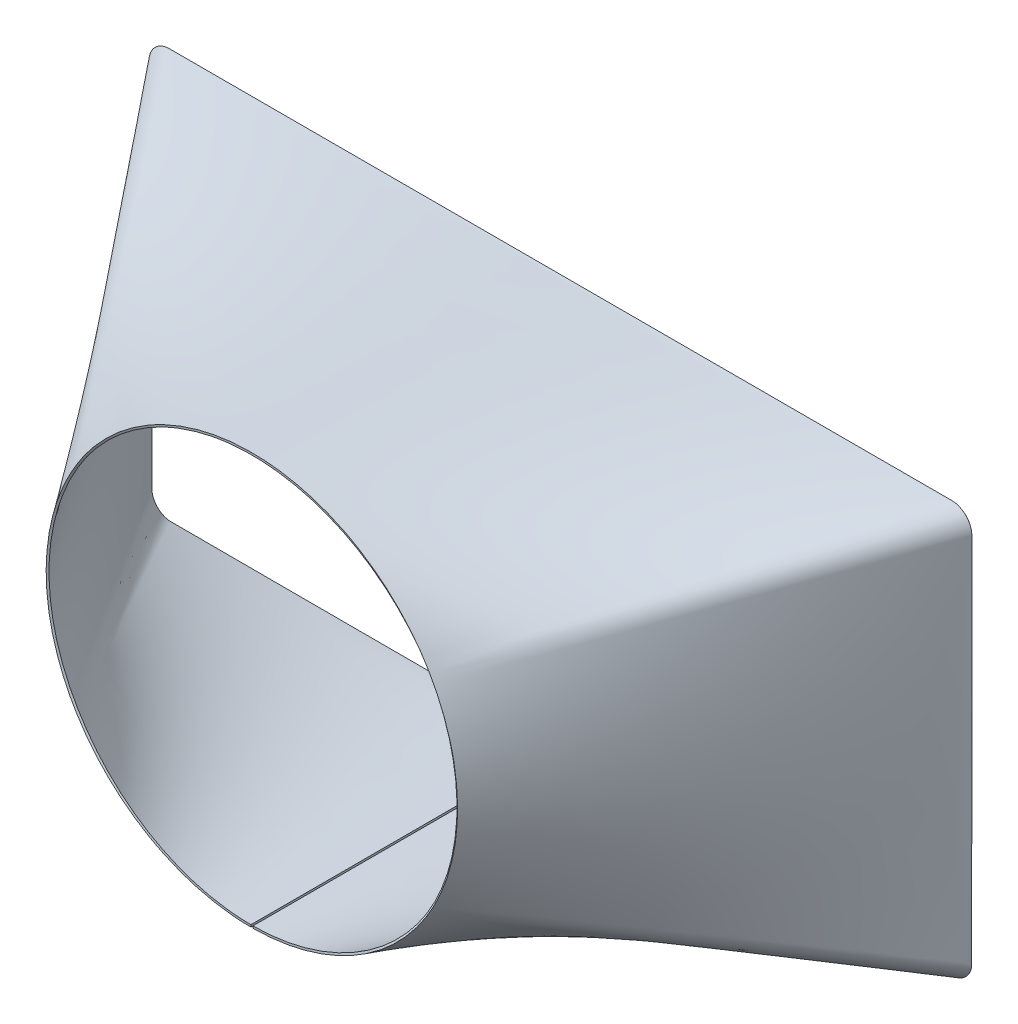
SolidWorks part; units mm, degrees
ref_plane "前视基准面" through (0, 0, 0) normal (0, 0, 1) x (1, 0, 0)
ref_plane "上视基准面" through (0, 0, 0) normal (0, 1, 0) x (1, 0, 0)
ref_plane "右视基准面" through (0, 0, 0) normal (1, 0, 0) x (0, 0, -1)
sketch "草图1" plane through (0, 0, 0) normal (0, 0, 1) x (1, 0, 0)
  line L0 (-0.5, -100) -> (-0.5, 0) construction
  line L1 (190, -100) -> (0.5, -100)
  line L2 (200, -90) -> (200, 90)
  line L3 (190, 100) -> (-190, 100)
  line L4 (-200, -90) -> (-200, 90)
  line L5 (200, -100) -> (-200, 100) construction
  line L6 (200, 100) -> (-200, -100) construction
  line L7 (-0.5, 0) -> (0.5, 0) construction
  line L8 (0.5, 0) -> (0.5, -100) construction
  line L9 (-0.5, -100) -> (-190, -100)
  arc A0 (200, 90) -> (190, 100) centre (190, 90) ccw
  arc A1 (200, -90) -> (190, -100) centre (190, -90) cw
  arc A2 (-200, -90) -> (-190, -100) centre (-190, -90) ccw
  arc A3 (-200, 90) -> (-190, 100) centre (-190, 90) cw
  point P0 (0, 0)
  dimension "R" = 10
  dimension "a" = 400
  dimension "b" = 200
  dimension "D3" = 1
ref_plane "基准面1" through (0, 0, 150) normal (0, 0, 1) x (1, 0, 0)
sketch "草图2" plane through (0, 0, 150) normal (0, 0, 1) x (1, 0, 0)
  line L0 (-0.5, 0) -> (0.5, 0) construction
  line L1 (0.5, 0) -> (0.5, -99.9987) construction
  line L2 (-0.5, 0) -> (-0.5, -99.9987) construction
  arc A0 (0.5, -99.9987) -> (-0.5, -99.9987) centre (0, 0) ccw
  dimension "r" = 100
  dimension "D1" = 1
sheet metal parameters "钣金1" thickness 1 parameters "D1"=0.7366, "厚度"=1
lofted bend "放样折弯1" thickness 1 parameters "D1"=0, "D12"=1
other "自由形折弯1" parameters "D1"=1000, "D4"=57.296, "D5"=1
flat pattern "平板型式1"
sketch "折弯-线1" plane through (0, 0, 0) normal (0, 1, 0) x (-1, 0, 0)
other "展开-<自由形折弯1>1"
